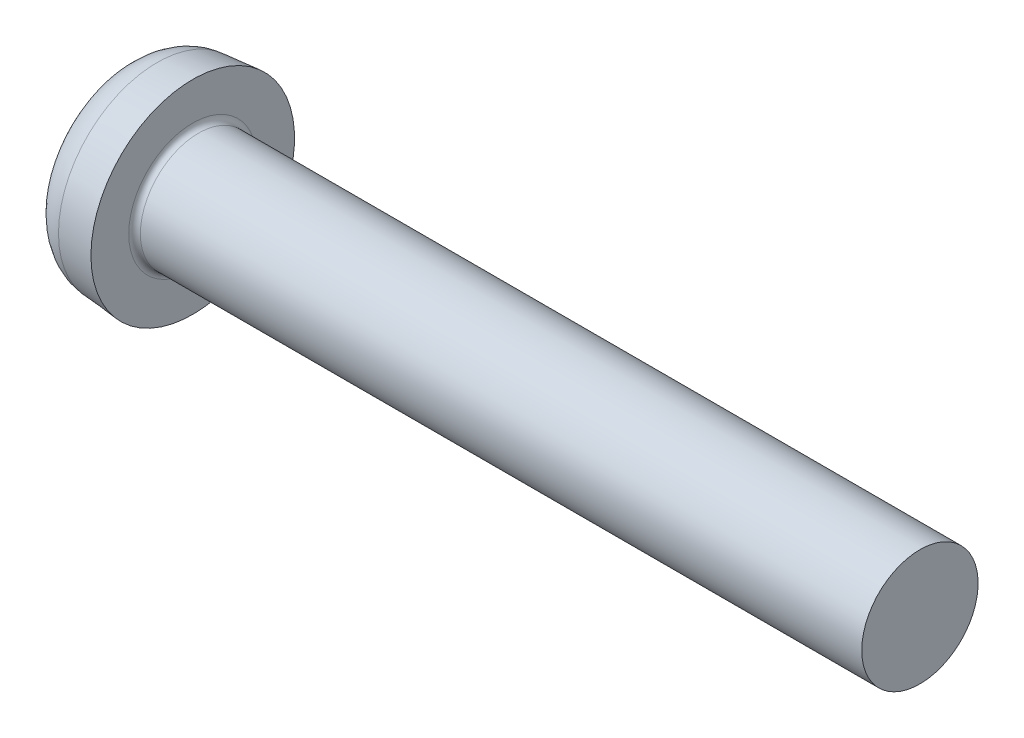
SolidWorks part; units mm, degrees
ref_plane "Front Plane" through (0, 0, 0) normal (0, 0, 1) x (1, 0, 0)
ref_plane "Top Plane" through (0, 0, 0) normal (0, 1, 0) x (1, 0, 0)
ref_plane "Right Plane" through (0, 0, 0) normal (1, 0, 0) x (0, 0, -1)
other "Configuration Table"
sketch "BodySke" plane through (0, 0, 0) normal (0, 0, 1) x (1, 0, 0)
  line L0 (0, 0) -> (111.3824, 0) construction
  line L1 (0, 0) -> (0, 8) construction
  line L2 (5.4, 4) -> (5.4, 7)
  line L3 (5.4, 7) -> (2.9561, 6.7862)
  line L4 (5.4, 4) -> (55.4, 4)
  line L5 (55.4, 4) -> (55.4, 0)
  line L6 (6.65, 7.824) -> (6.65, -6.8939) construction
  line L7 (0, 0) -> (55.4, 0)
  line L8 (25.4, 8.824) -> (25.4, -4.958) construction
  arc A0 (2.9561, 6.7862) -> (0.6811, 4.9045) centre (3.1827, 4.1961) ccw
  arc A1 (0.6811, 4.9045) -> (0, 0) centre (18, 0) ccw
  point P10 (55.4, 3.4455)
revolve "BaseBody" add sketch "BodySke" angle 360 about L0
fillet "Fillet1" radius 0.4 1 edges at (5.4, 0, 4)
ref_plane "Plane1" through (4.36, 0, 0) normal (1, 0, 0) x (0, 0, -1)
sketch "RecSkeTop" plane through (0, 0, 0) normal (1, 0, 0) x (0, 0, -1)
  line L1 (-0.858, 3.9) -> (0.858, 3.9)
  line L2 (-0.858, 3.9) -> (-0.858, -3.9)
  line L3 (-0.858, -3.9) -> (0.858, -3.9)
  line L4 (0.858, 3.9) -> (0.858, -3.9)
sketch "RecSkeBot" plane through (4.36, 0, 0) normal (1, 0, 0) x (0, 0, -1)
  line L0 (-0.858, 3.9) -> (-0.858, -3.9) construction
  line L1 (-0.858, 1.7262) -> (0.858, 1.7262)
  line L2 (-0.858, 1.7262) -> (-0.858, -1.7262)
  line L3 (-0.858, -1.7262) -> (0.858, -1.7262)
  line L4 (0.858, 1.7262) -> (0.858, -1.7262)
  line L5 (0.858, 3.9) -> (0.858, -3.9) construction
loft "Recess" cut profiles "RecSkeTop", "RecSkeBot"
pattern_circular "RecPat" count 2 every 90 about axis through (0, 0, 0) along (1, 0, 0) of "Recess"
sketch "RecCorSke" plane through (0, 0, 0) normal (0, 0, 1) x (1, 0, 0)
  line L0 (0, 0) -> (57.5987, 0) construction
  line L1 (0, 0) -> (0, 1.8876)
  line L3 (0, 1.8876) -> (4.36, 1.5827)
  line L4 (4.36, 1.5827) -> (4.8743, 0)
  line L5 (4.8743, 0) -> (0, 0)
revolve "RecessCore" cut sketch "RecCorSke" angle 360 about L0
sketch "ThdSchSke" plane through (0, 0, 0) normal (0, 0, 1) x (1, 0, 0)
  line L0 (0, 0) -> (55.1256, 0) construction
  line L1 (0, 0) -> (111.3824, 0) construction
  line L2 (55.0799, 4) -> (55.0799, 4.6403)
  line L3 (55.0799, 4.6403) -> (55.7201, 4.6403)
  line L4 (55.7201, 4.6403) -> (55.7201, 4)
  line L5 (55.7201, 4) -> (55.4, 3.4455)
  line L6 (55.4, 3.4455) -> (55.0799, 4)
  line L7 (5.4, 4) -> (55.4, 4) construction
  line L13 (55.4, 4) -> (55.4, 0) construction
revolve "ThreadSchematic" [suppressed] cut sketch "ThdSchSke" angle 360 about L0
pattern_linear "ThdSchPat" [suppressed] count 24 along (1, 0, 0)
equation "\"Thread_minor@ThreadCosmetic\" = \"Thread_minor@BodySke\""
equation "\"D1@RecSkeTop\" = \"Cross_dia@RecSkeTop\" / 2"
equation "\"D2@RecSkeTop\" = \"Cross_dia@RecSkeTop\" * 0.22"
equation "\"D3@RecSkeTop\" = \"D2@RecSkeTop\" / 2"
equation "\"D1@RecSkeBot\" = \"Cross_dia@RecSkeTop\" - 2 * \"Cross_depth@Plane1\" *  tan( 26.5 * 0.017453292 ) "
equation "\"D2@RecSkeBot\" = \"D1@RecSkeBot\" / 2"
equation "\"D2@RecCorSke\" = \"Cross_depth@Plane1\""
equation "\"D3@RecCorSke\" = \"D2@RecSkeTop\" * 1.1"
equation "\"Advance@ThdSchPat\" = \"Advance@BodySke\""
equation "\"D1@ThdSchPat\" =  int( \"Thread_length@BodySke\" / \"Advance@ThdSchPat\" ) "
